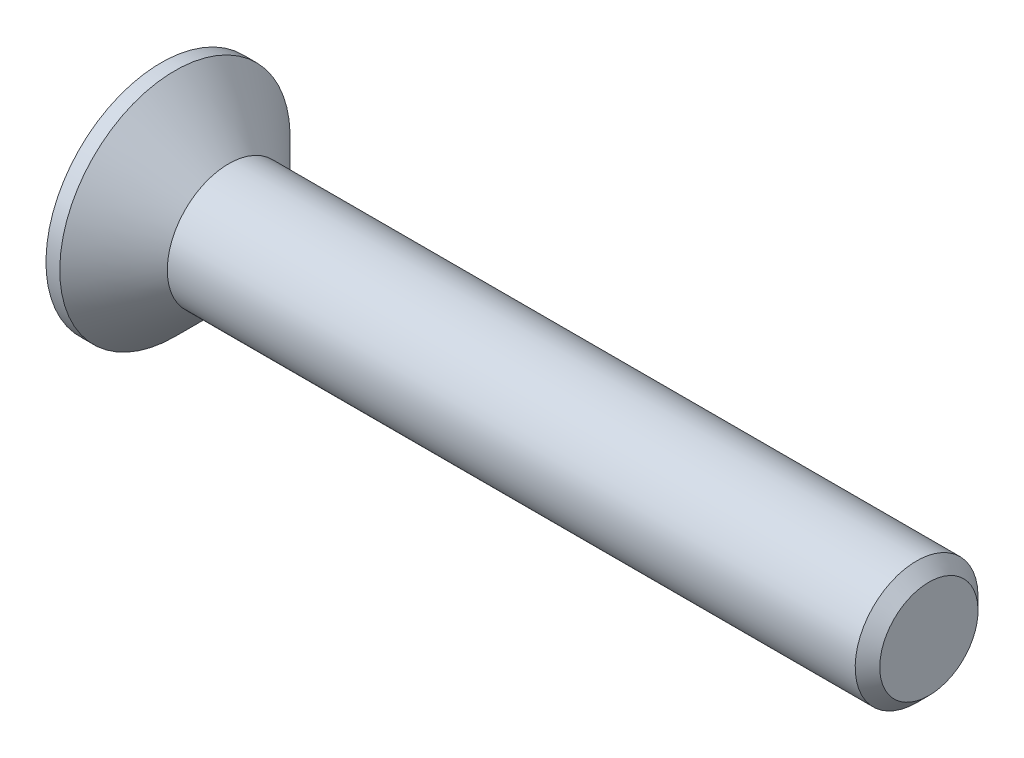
SolidWorks part; units mm, degrees
ref_plane "Front Plane" through (0, 0, 0) normal (0, 0, 1) x (1, 0, 0)
ref_plane "Top Plane" through (0, 0, 0) normal (0, 1, 0) x (1, 0, 0)
ref_plane "Right Plane" through (0, 0, 0) normal (1, 0, 0) x (0, 0, -1)
sketch "Sketch1" plane through (0, 0, 0) normal (0, 0, 1) x (1, 0, 0)
  line L1 (-2.2, 3.75) -> (-2.2, 0)
  line L2 (-2.2, 0) -> (22.8, 0)
  line L3 (22.8, 0) -> (22.8, 2)
  line L4 (22.8, 2) -> (0, 2)
  line L5 (-2.2, 3.75) -> (-1.75, 3.75)
  line L6 (-1.75, 3.75) -> (0, 2)
  dimension "D1" = 2
  dimension "D2" = 45
  dimension "D3" = 2.2
  dimension "D4" = 25
  dimension "D5" = 3.75
revolve "Revolve1" add sketch "Sketch1" angle 360 about L2
chamfer "Chamfer1" distance 0.4 angle 45 1 edges at (22.8, -2, 0)
sketch "Sketch2" plane through (-2.2, 0, 0) normal (-1, 0, 0) x (0, 0, 1)
  line L0 (-0.55, 2.2) -> (0.55, 2.2)
  line L1 (0.55, 2.2) -> (0.55, 0.55)
  line L2 (0.55, 0.55) -> (2.2, 0.55)
  line L3 (2.2, 0.55) -> (2.2, -0.55)
  line L4 (2.2, -0.55) -> (0.55, -0.55)
  line L5 (0.55, -0.55) -> (0.55, -2.2)
  line L6 (0.55, -2.2) -> (-0.55, -2.2)
  line L7 (-0.55, -2.2) -> (-0.55, -0.55)
  line L8 (-0.55, -0.55) -> (-2.2, -0.55)
  line L9 (-2.2, -0.55) -> (-2.2, 0.55)
  line L10 (-2.2, 0.55) -> (-0.55, 0.55)
  line L11 (-0.55, 0.55) -> (-0.55, 2.2)
  point P2 (0, 2.2)
  point P14 (0, -2.2)
  point P15 (2.2, 0)
  point P16 (-2.2, 0)
  dimension "D1" = 4.4
  dimension "D2" = 1.1
extrude "Cut-Extrude1" cut sketch "Sketch2" against normal blind 1.9
